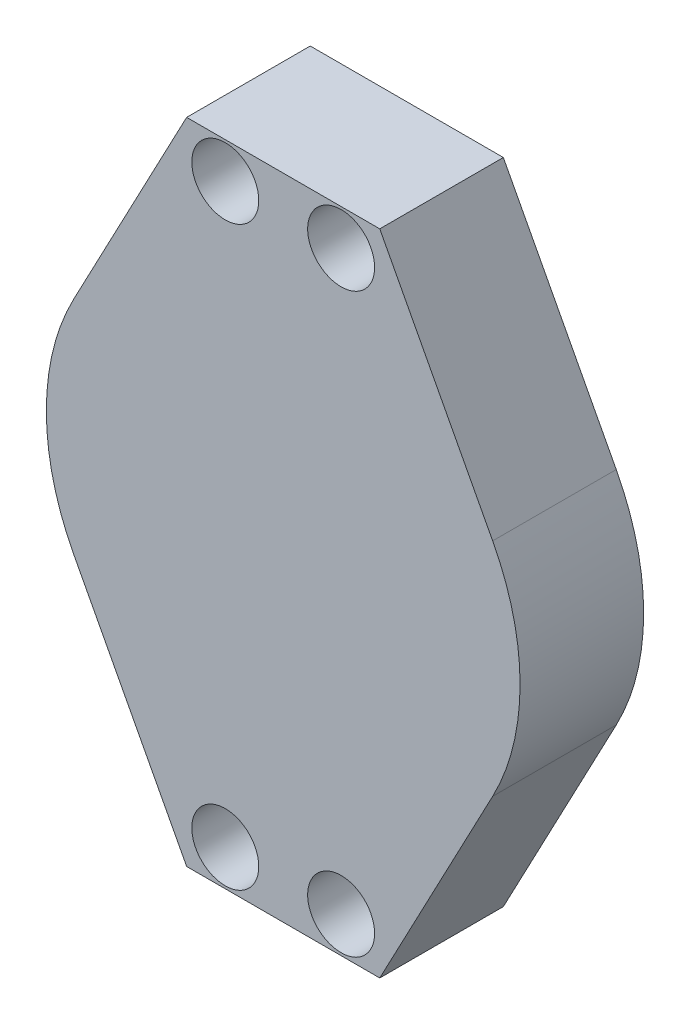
SolidWorks part; units mm, degrees
ref_plane "Plan de face" through (0, 0, 0) normal (0, 0, 1) x (1, 0, 0)
ref_plane "Plan de dessus" through (0, 0, 0) normal (0, 1, 0) x (1, 0, 0)
ref_plane "Plan de droite" through (0, 0, 0) normal (1, 0, 0) x (0, 0, -1)
sketch "Esquisse1" plane through (0, 0, 0) normal (0, 0, 1) x (1, 0, 0)
  line L0 (-37.5, 126) -> (37.5, 126)
  line L1 (0, 0) -> (0, 209.6588) construction
  line L2 (37.5, 126) -> (81.3524, 42.9626)
  line L3 (-37.5, 126) -> (-81.3524, 42.9626)
  line L4 (-133.1901, 0) -> (126.4675, 0) construction
  line L5 (-37.5, -126) -> (-81.3524, -42.9626)
  line L6 (37.5, -126) -> (81.3524, -42.9626)
  line L7 (-37.5, -126) -> (37.5, -126)
  arc A0 (-81.3524, 42.9626) -> (-81.3524, -42.9626) centre (0, 0) ccw
  arc A1 (81.3524, -42.9626) -> (81.3524, 42.9626) centre (0, 0) ccw
  dimension "D1" = 37.5
  dimension "D2" = 75
  dimension "D3" = 126
extrude "Extrusion1" add sketch "Esquisse1" along normal blind 48
sketch "Esquisse2" plane through (0, 0, 0) normal (0, 0, -1) x (-1, 0, 0)
  circle A0 centre (0, 0) radius 90
extrude "Enlèv. mat.-Extru.1" cut sketch "Esquisse2" against normal blind 32
hole_wizard "Chambrage pour vis à tête ronde bombée M101" positions "Esquisse4" profile "Esquisse3" counterbore size "M10" standard "Ansi Métrique"
sketch "Esquisse4" plane through (0, 0, 48) normal (0, 0, 1) x (1, 0, 0)
  point P0 (-22.5, 112)
  dimension "D1" = 112
  dimension "D2" = 22.5
sketch "Esquisse3" plane through (-22.5, 112, 48) normal (1, 0, 0) x (0, -1, 0)
  line L0 (0, 0) -> (0, 48)
  line L1 (0, 48) -> (6.5, 48)
  line L3 (6.5, 48) -> (6.5, 37.5)
  line L4 (6.5, 37.5) -> (13, 37.5)
  line L5 (13, 37.5) -> (13, 0)
  line L7 (13, 0) -> (0, 0)
  line L11 (0, -6.35) -> (0, 107.95) construction
  dimension "Diamètre du perçage jusqu'au prochain" = 13
  dimension "Profondeur du perçage jusqu'au prochain" = 48
  dimension "Diamètre du chambrage" = 26
  dimension "Profondeur du chambrage" = 37.5
mirror "Symétrie1" about plane through (0, 0, 0) normal (1, 0, 0) of "Chambrage pour vis à tête ronde bombée M101"
mirror "Symétrie2" about plane through (0, 0, 0) normal (0, 1, 0) of "Symétrie1", "Chambrage pour vis à tête ronde bombée M101"
